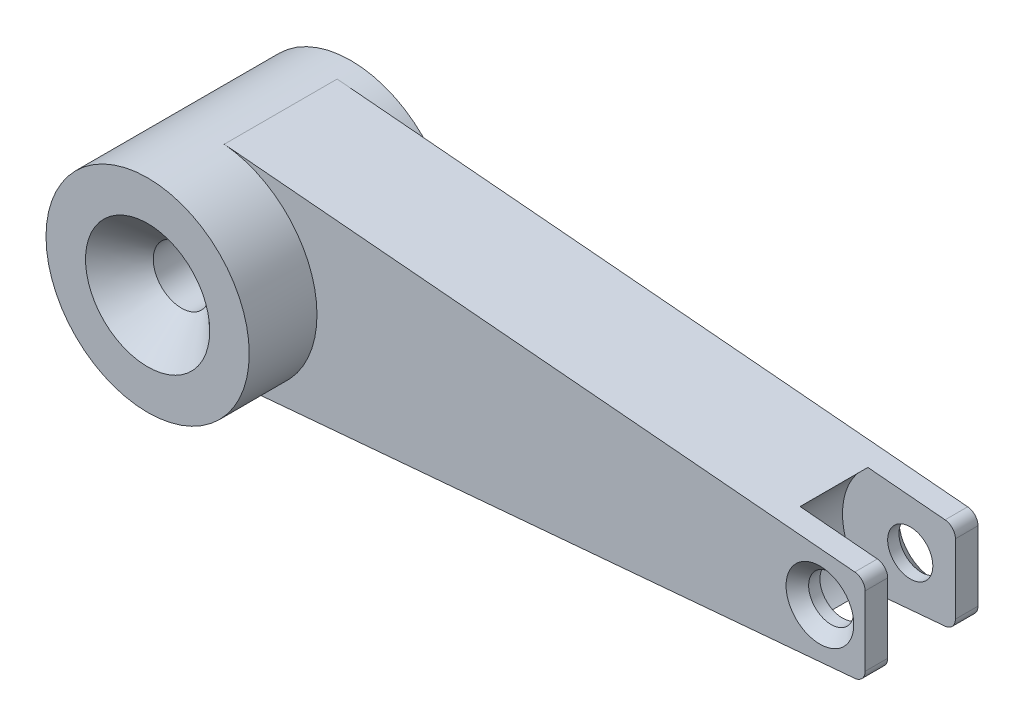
SolidWorks part; units mm, degrees
ref_plane "Ön Düzlem" through (0, 0, 0) normal (0, 0, 1) x (1, 0, 0)
ref_plane "Üst Düzlem" through (0, 0, 0) normal (0, 1, 0) x (1, 0, 0)
ref_plane "Sağ Düzlem" through (0, 0, 0) normal (1, 0, 0) x (0, 0, -1)
sketch "Çizim1" plane through (0, 0, 0) normal (0, 0, 1) x (1, 0, 0)
  circle A0 centre (0, 0) radius 9
  dimension "D1" = 18
extrude "Yükseklik-Ekstrüzyon1" add sketch "Çizim1" along normal blind 18
sketch "Çizim2" plane through (0, 0, 0) normal (0, 0, 1) x (1, 0, 0)
  line L0 (0.7844, 8.9658) -> (57.5432, 4)
  line L1 (57.5432, 4) -> (57.5432, -4)
  line L2 (57.5432, -4) -> (0.7844, -8.9658)
  line L3 (0, 13.6672) -> (0, -21.2983) construction
  line L4 (-17.154, 0) -> (26.2628, 0) construction
  line L5 (0.7844, 8.9658) -> (0.7844, -8.9658)
  circle A0 centre (0, 0) radius 9 construction
  dimension "D1" = 5
  dimension "D2" = 5
  dimension "D3" = 8
extrude "Yükseklik-Ekstrüzyon2" add sketch "Çizim2" along normal blind 12
sketch "Çizim4" plane through (0, 0, 0) normal (0, 0, -1) x (-1, 0, 0)
  line L0 (-0.7844, 8.9658) -> (-57.5432, 4)
  line L1 (-57.5432, 4) -> (-57.5432, -4)
  line L2 (-57.5432, -4) -> (-0.7844, -8.9658)
  arc A0 (-0.7844, 8.9658) -> (-0.7844, -8.9658) centre (0, 0) ccw
extrude "Kes-Ekstrüzyon1" cut sketch "Çizim4" against normal blind 2
sketch "Çizim5" plane through (0, 0, 0) normal (0, 0, -1) x (-1, 0, 0)
  circle A0 centre (0, 0) radius 2.5
  dimension "D1" = 5
extrude "Kes-Ekstrüzyon2" cut sketch "Çizim5" against normal blind 29
ref_plane "Düzlem1" through (0, 0, 7) normal (0, 0, 1) x (1, 0, 0)
sketch "Çizim6" plane through (0, 0, 7) normal (0, 0, 1) x (1, 0, 0)
  line L1 (57.5432, -4) -> (57.5432, 4) construction
  circle A1 centre (53.5432, 0) radius 6
  dimension "D1" = 12
  dimension "D2" = 4
extrude "Kes-Ekstrüzyon3" cut sketch "Çizim6" against normal blind 3 and the other way blind 3
chamfer "Pah1" distance 3 angle 45 2 edges at (2.5, 0, 18) (-2.5, 0, 0)
fillet "Radyus1" radius 1 4 edges at (57.5432, -4, 3) (57.5432, 4, 3) (57.5432, -4, 11) (57.5432, 4, 11)
sketch "Çizim7" plane through (0, 0, 12) normal (0, 0, 1) x (1, 0, 0)
  line L0 (57.5432, -3.0837) -> (57.5432, 3.0837) construction
  circle A0 centre (53.5432, 0) radius 2
  dimension "D1" = 4
  dimension "D2" = 4
extrude "Kes-Ekstrüzyon4" cut sketch "Çizim7" against normal blind 13
chamfer "Pah2" distance 1 angle 45 2 edges at (51.5432, 0, 2) (55.5432, 0, 12)
